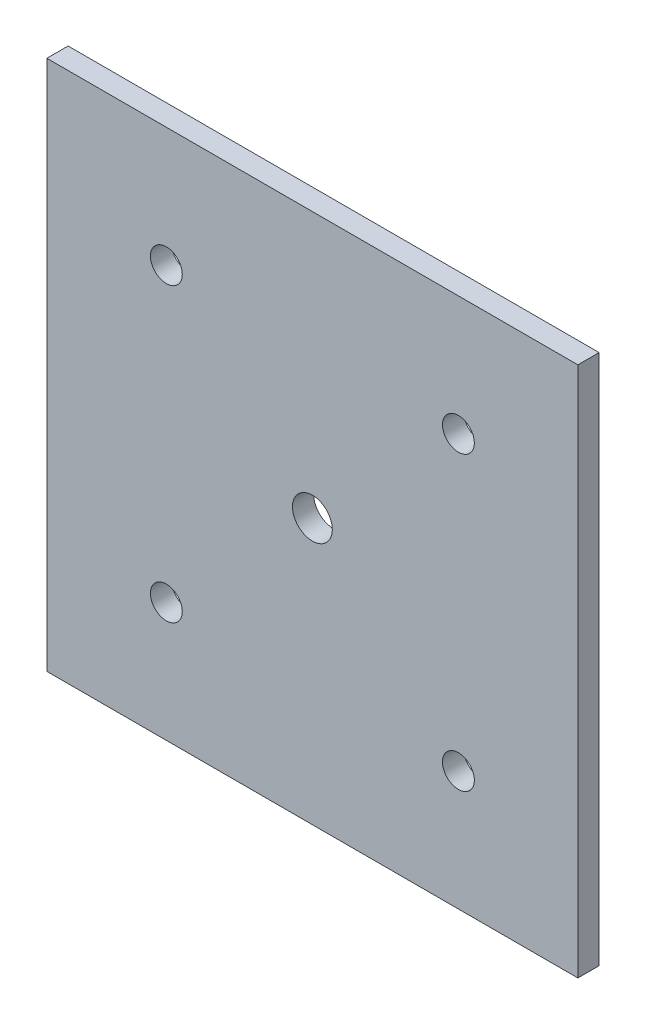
SolidWorks part; units mm, degrees
ref_plane "Front Plane" through (0, 0, 0) normal (1, 0, 0) x (0, 1, 0)
ref_plane "Top Plane" through (0, 0, 0) normal (0, 0, 1) x (0, 1, 0)
ref_plane "Right Plane" through (0, 0, 0) normal (0, 1, 0) x (-1, 0, 0)
sketch "Sketch1" plane through (0, 0, 0) normal (0, 0, 1) x (0, 1, 0)
  line L1 (-100, -100) -> (100, -100)
  line L2 (-100, -100) -> (-100, 100)
  line L3 (-100, 100) -> (100, 100)
  line L4 (100, -100) -> (100, 100)
  line L5 (-100, -100) -> (100, 100) construction
  line L6 (-100, 100) -> (100, -100) construction
  point P0 (0, 0)
  dimension "D1" = 200
  dimension "D2" = 200
extrude "Boss-Extrude1" add sketch "Sketch1" along normal blind 8
sketch "Sketch2" plane through (0, 0, 0) normal (0, 0, 1) x (0, 1, 0)
  line L0 (100, 100) -> (-100, 100) construction
  line L1 (-100, 100) -> (-100, -100) construction
  line L2 (100, -100) -> (100, 100) construction
  line L3 (-100, -100) -> (100, -100) construction
  circle A0 centre (-55, 55) radius 6
  circle A1 centre (55, 55) radius 6
  circle A2 centre (-55, -55) radius 6
  circle A3 centre (55, -55) radius 6
  dimension "D1" = 12
  dimension "D2" = 12
  dimension "D3" = 12
  dimension "D4" = 12
  dimension "D5" = 45
  dimension "D6" = 45
  dimension "D7" = 45
  dimension "D8" = 45
  dimension "D9" = 45
  dimension "D10" = 45
  dimension "D11" = 45
  dimension "D12" = 45
extrude "Cut-Extrude1" cut sketch "Sketch2" along normal through all
sketch "Sketch3" plane through (0, 0, 0) normal (0, 0, 1) x (0, 1, 0)
  circle A0 centre (0, 0) radius 7.5
  dimension "D1" = 15
extrude "Cut-Extrude2" cut sketch "Sketch3" along normal through all
